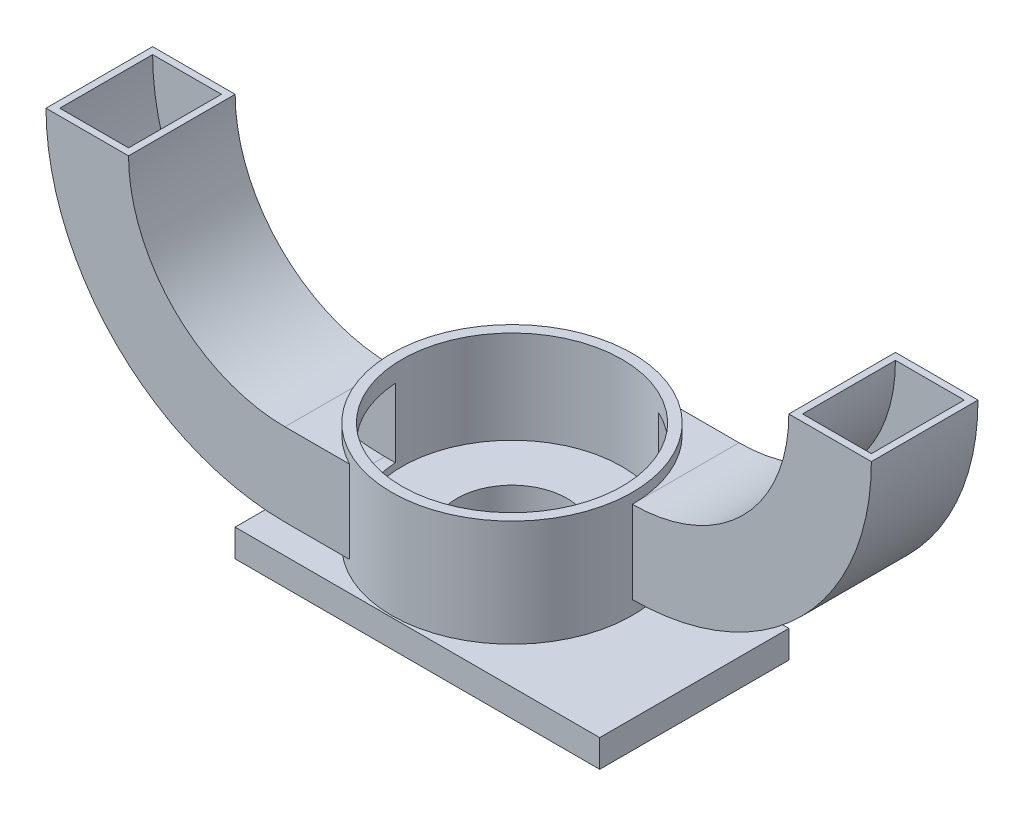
SolidWorks part; units mm, degrees
ref_plane "Front Plane" through (0, 0, 0) normal (0, 0, 1) x (1, 0, 0)
ref_plane "Top Plane" through (0, 0, 0) normal (0, 1, 0) x (1, 0, 0)
ref_plane "Right Plane" through (0, 0, 0) normal (1, 0, 0) x (0, 0, -1)
sketch "Sketch1" plane through (0, 0, 0) normal (0, 1, 0) x (1, 0, 0)
  line L1 (-26.5, 13.75) -> (26.5, 13.75)
  line L2 (-26.5, 13.75) -> (-26.5, -13.75)
  line L3 (-26.5, -13.75) -> (26.5, -13.75)
  line L4 (26.5, 13.75) -> (26.5, -13.75)
  line L5 (-26.5, 13.75) -> (26.5, -13.75) construction
  line L6 (-26.5, -13.75) -> (26.5, 13.75) construction
  point P0 (0, 0)
  dimension "D1" = 53
  dimension "D2" = 27.5
extrude "Boss-Extrude1" add sketch "Sketch1" along normal blind 4
sketch "Sketch2" plane through (0, 4, 0) normal (0, 1, 0) x (1, 0, 0)
  circle A0 centre (0, 0) radius 8
  circle A1 centre (0, 0) radius 9.5
  dimension "D1" = 16
  dimension "D2" = 19
extrude "Boss-Extrude2" add sketch "Sketch2" along normal blind 4
loft "Cut-Loft1" cut
sketch "Sketch3" plane through (0, 8, 0) normal (0, 1, 0) x (1, 0, 0)
  circle A0 centre (0, 0) radius 16
  circle A1 centre (0, 0) radius 8
  dimension "D1" = 32
  dimension "D2" = 16
extrude "Boss-Extrude3" add sketch "Sketch3" along normal blind 2
sketch "Sketch4" plane through (0, 8, 0) normal (0, 1, 0) x (1, 0, 0)
  circle A0 centre (0, 0) radius 16
  circle A1 centre (0, 0) radius 17.5
  dimension "D1" = 35
  dimension "D2" = 32
extrude "Boss-Extrude4" add sketch "Sketch4" along normal blind 15.5
ref_plane "Plane1" through (17.5, 0, 0) normal (1, 0, 0) x (0, 0, -1)
sketch "Sketch5" plane through (17.5, 0, 0) normal (1, 0, 0) x (0, 0, -1)
  line L1 (-17.5, 8) -> (17.5, 8) construction
  line L2 (0, 12.9285) -> (0, -12.9285) construction
  line L3 (0, 10) -> (15.5, 10)
  line L4 (0, 10) -> (0, 22)
  line L5 (0, 22) -> (15.5, 22)
  line L6 (15.5, 10) -> (15.5, 22)
  line L7 (17.5, 8) -> (17.5, 23.5) construction
  line L9 (1, 11) -> (14.5, 11)
  line L10 (1, 11) -> (1, 21)
  line L11 (1, 21) -> (14.5, 21)
  line L12 (14.5, 11) -> (14.5, 21)
  dimension "D2" = 2
  dimension "D3" = 2
  dimension "D4" = 12
  dimension "D5" = 1
  dimension "D6" = 1
  dimension "D7" = 1
  dimension "D8" = 1
sketch "Sketch6" plane through (0, 0, 0) normal (1, 0, 0) x (0, 0, -1)
  line L0 (0, 24.5851) -> (0, -24.5851) construction
  line L1 (0, 10) -> (-15.5, 10)
  line L2 (0, 10) -> (0, 22)
  line L3 (0, 22) -> (-15.5, 22)
  line L4 (-15.5, 10) -> (-15.5, 22)
  line L5 (-17.5, 8) -> (17.5, 8) construction
  line L6 (-17.5, 23.5) -> (-17.5, 8) construction
  dimension "D1" = 2
  dimension "D2" = 2
  dimension "D3" = 12
extrude "Boss-Extrude5" add sketch "Sketch5" against normal up to next
sketch "Sketch10" plane through (17.5, 0, 0) normal (1, 0, 0) x (0, 0, -1)
  line L0 (1, 11) -> (14.5, 21) construction
  line L1 (1, 11) -> (14.5, 11)
  line L2 (1, 11) -> (1, 21)
  line L3 (1, 21) -> (14.5, 21)
  line L4 (14.5, 11) -> (14.5, 21)
  line L5 (14.5, 11) -> (1, 21) construction
extrude "Cut-Extrude3" cut sketch "Sketch10" against normal up to surface (1.5313 mm away) contours L3 L4 L1 L2
ref_plane "Plane2" through (0, 0, -7.75) normal (0, 0, 1) x (1, 0, 0)
sketch "Sketch11" plane through (0, 0, -7.75) normal (0, 0, 1) x (1, 0, 0)
  line L0 (17.5, 16) -> (12.2107, 16) construction
  line L1 (17.5, -12.9285) -> (17.5, 12.9285) construction
  line L2 (17.5, 11) -> (17.5, 21) construction
  line L3 (6.7639, 11) -> (17.5, 11) construction
  line L4 (15.9687, 21) -> (17.5, 21) construction
  arc A0 (17.5, 16) -> (46.2424, 44.7432) centre (17.5, 44.7424) ccw
  point P9 (0, 0)
  point P12 (0, 0)
  point P15 (0, 0)
  dimension "D2" = 28.7424
extrude "Cut-Extrude4" cut sketch "Sketch6" against normal up to next
sketch "Sketch13" plane through (17.5, 0, 0) normal (1, 0, 0) x (0, 0, -1)
  line L0 (7.75, 11) -> (7.75, 21) construction
  line L1 (15.5, 10) -> (0, 10)
  line L2 (15.5, 10) -> (15.5, 22)
  line L3 (15.5, 22) -> (0, 22)
  line L4 (0, 10) -> (0, 22)
  line L5 (15.5, 10) -> (0, 22) construction
  line L6 (15.5, 22) -> (0, 10) construction
  line L7 (15.5, 22) -> (0, 22) construction
  line L8 (15.5, 10) -> (15.5, 22) construction
  line L9 (14.5, 21) -> (1, 21) construction
  line L10 (14.5, 11) -> (1, 11)
  line L11 (14.5, 11) -> (14.5, 21)
  line L12 (14.5, 21) -> (1, 21)
  line L13 (1, 11) -> (1, 21)
  line L14 (14.5, 11) -> (1, 21) construction
  line L15 (14.5, 21) -> (1, 11) construction
  line L16 (14.5, 11) -> (14.5, 21) construction
  point P0 (7.75, 16)
  point P11 (7.75, 16)
sweep "Sweep3" add profiles "Sketch13" path "Sketch11"
pattern_circular "CirPattern19" count 2 over 360 about axis through (0, 0, 0) along (0, 1, 0) of "Boss-Extrude5", "Sweep3"
sketch "Sketch14" plane through (0, 10, 0) normal (0, 1, 0) x (1, 0, 0)
  circle A0 centre (0, 0) radius 16
extrude "Cut-Extrude5" cut sketch "Sketch14" along normal up to next
